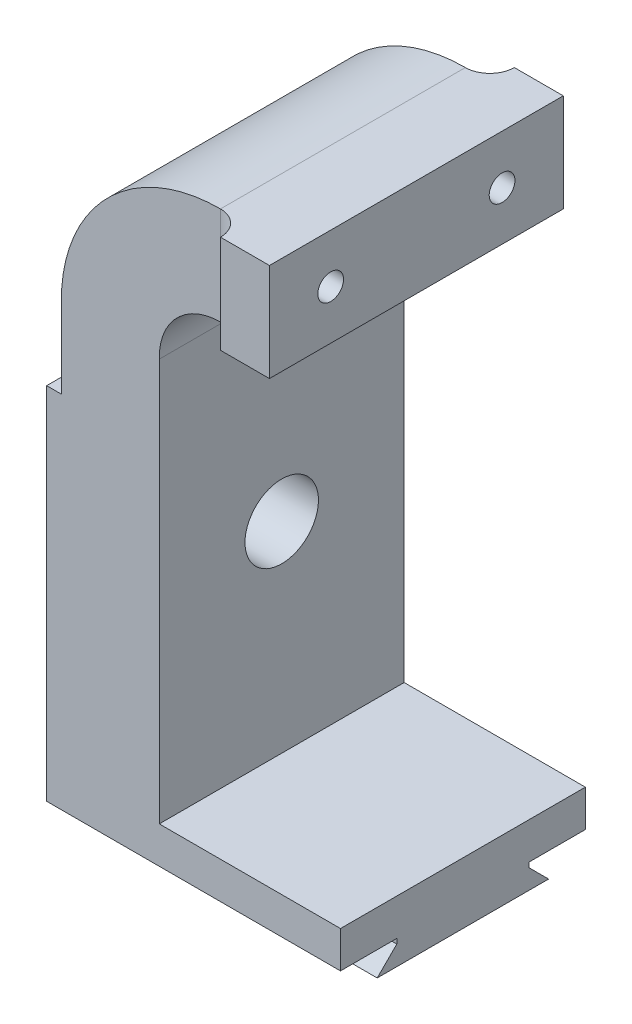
SolidWorks part; units mm, degrees
ref_plane "Front Plane" through (0, 0, 0) normal (0, 0, 1) x (1, 0, 0)
ref_plane "Top Plane" through (0, 0, 0) normal (0, 1, 0) x (1, 0, 0)
ref_plane "Right Plane" through (0, 0, 0) normal (1, 0, 0) x (0, 0, -1)
ref_plane "Plane1" through (-147.5, 0, -50) normal (1, 0, 0) x (0, 0, -1)
sketch "Sketch3" plane through (-147.5, 0, 0) normal (-1, 0, 0) x (0, 0, 1)
  line L0 (-35, 32) -> (35, 32) construction
  line L1 (-27, 40) -> (-35, 32) construction
  line L3 (35, 32) -> (27, 40) construction
  line L5 (-35, 32) -> (35, 32)
  line L6 (-27, 40) -> (-35, 32)
  line L7 (-27, 42) -> (-27, 40) construction
  line L8 (35, 32) -> (27, 40)
  line L9 (-27, 42) -> (-50, 42) construction
  line L10 (27, 40) -> (27, 42) construction
  line L11 (50, 42) -> (27, 42) construction
  line L12 (-27, 42) -> (-27, 40)
  line L13 (-27, 42) -> (-50, 42)
  line L14 (27, 40) -> (27, 42)
  line L15 (50, 42) -> (27, 42)
  line L16 (-50, 42) -> (-50, 57)
  line L17 (-50, 64) -> (-50, 27) construction
  line L18 (-50, 57) -> (50, 57)
  line L19 (50, 64) -> (50, 27) construction
  line L20 (50, 57) -> (50, 42)
  dimension "D1" = 25
extrude "Boss-Extrude1" add sketch "Sketch3" against normal blind 120
sketch "Sketch4" plane through (0, 0, 0) normal (0, 0, 1) x (1, 0, 0)
  line L0 (-101.5, 57) -> (-147.5, 57)
  line L17 (-46.5077, 247) -> (-76.5077, 247)
  line L18 (-46.5077, 287) -> (-46.5077, 247)
  line L19 (-76.5077, 287) -> (-46.5077, 287)
  line L20 (-141.5, 189) -> (-147.5, 189)
  line L21 (-141.5, 221) -> (-141.5, 189)
  line L22 (-101.5, 221.3799) -> (-101.5, 57)
  line L23 (-147.5, 189) -> (-147.5, 57)
  arc A2 (-141.5, 221) -> (-76.5077, 287) centre (-76.5077, 222) cw
  arc A3 (-101.5, 221.3799) -> (-76.5077, 247) centre (-76.5077, 222) cw
  dimension "D3" = 32
  dimension "D5" = 65
  dimension "D8" = 25
  dimension "D1" = 46
  dimension "D2" = 132
  dimension "D4" = 6
  dimension "D6" = 30
  dimension "D7" = 40
  dimension "D9" = 230
extrude "Boss-Extrude2" add sketch "Sketch4" along normal up to surface and the other way up to surface
sketch "Sketch5" plane through (0, 0, 50) normal (0, 0, 1) x (1, 0, 0)
  line L0 (-76.5077, 247) -> (-46.5077, 247) construction
  line L1 (-46.5077, 287) -> (-66.5077, 287)
  line L2 (-46.5077, 287) -> (-46.5077, 247)
  line L3 (-46.5077, 247) -> (-66.5077, 247)
  line L4 (-66.5077, 287) -> (-66.5077, 247)
  dimension "D1" = 20
extrude "Boss-Extrude3" add sketch "Sketch5" along normal blind 10
mirror "Mirror1" about plane through (0, 0, 0) normal (0, 0, 1) of "Boss-Extrude3"
fillet "Fillet1" radius 10 2 edges
sketch "Sketch6" plane through (-101.5, 0, 0) normal (1, 0, 0) x (0, 0, -1)
  line L0 (-50, 57) -> (50, 57) construction
  circle A0 centre (0, 139) radius 15
  dimension "D1" = 30
  dimension "D2" = 82
extrude "Cut-Extrude1" cut sketch "Sketch6" against normal through all
hole_wizard "M12x1.5 Tapped Hole1" positions "Sketch8" profile "Sketch7" tap size "M12x1.5" standard "ANSI Metric"
sketch "Sketch8" plane through (-46.5077, 0, 0) normal (1, 0, 0) x (0, 0, -1)
  line L0 (-60, 247) -> (60, 247) construction
  line L1 (0, 0) -> (0, 284.32) construction
  point P0 (-35, 267)
  point P2 (35, 267)
  dimension "D1" = 70
  dimension "D2" = 20
sketch "Sketch7" plane through (-46.5077, 267, 35) normal (0, 1, 0) x (0, 0, -1)
  line L0 (0, 0) -> (0, 31.6545)
  line L1 (0, 31.6545) -> (5.25, 28.5)
  line L2 (5.25, 28.5) -> (5.25, 0)
  line L5 (5.25, 0) -> (0, 0)
  line L10 (0, 31.6545) -> (-5.25, 28.5) construction
  line L11 (0, -6.35) -> (0, 107.95) construction
  dimension "Tap Drill Dia." = 10.5
  dimension "Tap Drill Depth" = 28.5
  dimension "Drill Angle" = 118
